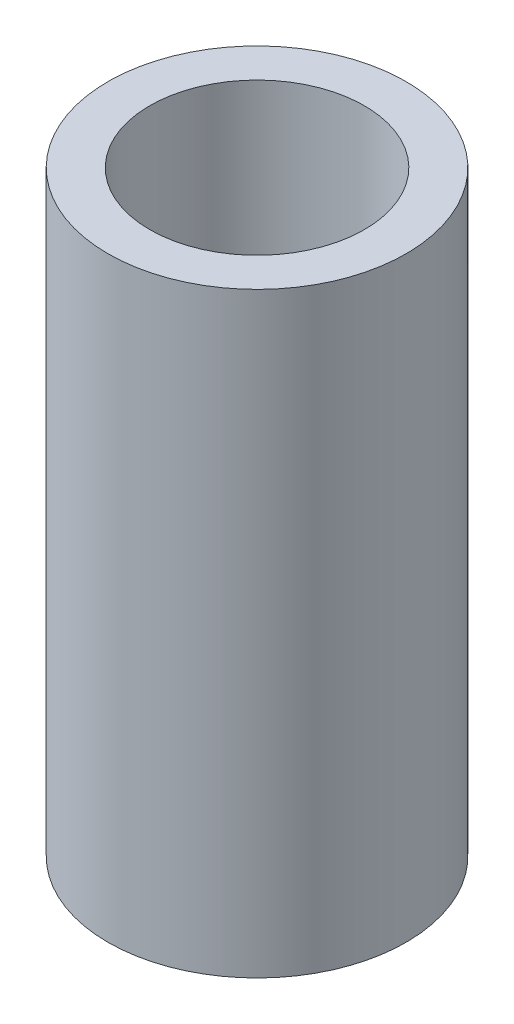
SolidWorks part; units mm, degrees
ref_plane "Front Plane" through (0, 0, 0) normal (0, 0, 1) x (1, 0, 0)
ref_plane "Top Plane" through (0, 0, 0) normal (0, 1, 0) x (1, 0, 0)
ref_plane "Right Plane" through (0, 0, 0) normal (1, 0, 0) x (0, 0, -1)
sketch "Sketch1" plane through (0, 0, 0) normal (0, 1, 0) x (1, 0, 0)
  circle A0 centre (0, 0) radius 9
  circle A1 centre (0, 0) radius 12.5
  dimension "D1" = 18
  dimension "D2" = 25
extrude "Boss-Extrude1" add sketch "Sketch1" along normal blind 50
